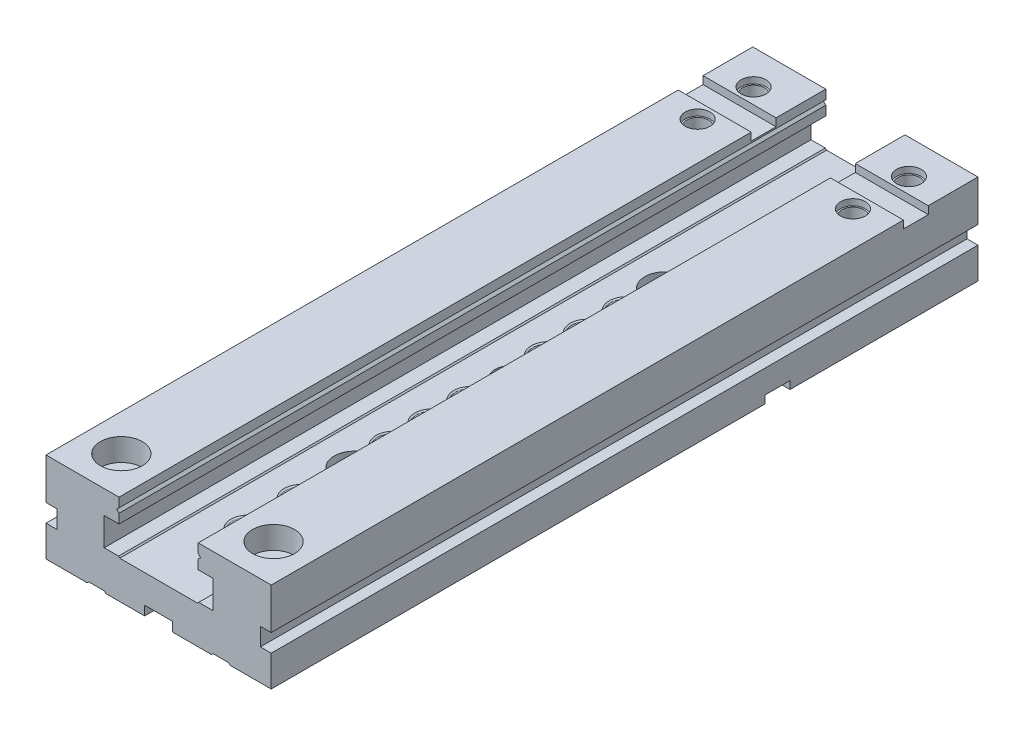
SolidWorks part; units mm, degrees
ref_plane "Front Plane" through (0, 0, 0) normal (0, 0, 1) x (1, 0, 0)
ref_plane "Top Plane" through (0, 0, 0) normal (0, 1, 0) x (1, 0, 0)
ref_plane "Right Plane" through (0, 0, 0) normal (1, 0, 0) x (0, 0, -1)
imported_body "Imported1"
sketch "Sketch1" plane through (0, -4.8, 0) normal (0, 1, 0) x (1, 0, 0)
  circle A0 centre (0, 126) radius 12.4968
  circle A1 centre (0, 326) radius 12.4968
  circle A2 centre (0, 226) radius 9.5
extrude "Boss-Extrude1" add sketch "Sketch1" against normal up to surface (18.2 mm away)
hole_wizard "Hole1" positions "Sketch3" profile "Sketch2" legacy
sketch "Sketch3" plane through (0, -4.8, 0) normal (0, 1, 0) x (1, 0, 0)
  line L1 (-25, 455) -> (25, 455) construction
  point P0 (0, 126)
  point P2 (0, 326)
  dimension "D1" = 129
  dimension "D2" = 200
sketch "Sketch2" plane through (0, -4.8, -126) normal (1, 0, 0) x (0, 0, 1)
  line L0 (0, 0) -> (0, 100)
  line L1 (0, 100) -> (8, 100)
  line L2 (8, 100) -> (8, 11)
  line L3 (8, 11) -> (13, 11)
  line L4 (13, 11) -> (13, 0)
  line L5 (13, 0) -> (0, 0)
  line L6 (0, 110) -> (0, -10) construction
  dimension "Diameter" = 16
  dimension "Depth" = 100
  dimension "C-Bore Diameter" = 26
  dimension "C-Bore Depth" = 11
hole_wizard "Hole2" positions "Sketch5" profile "Sketch4" legacy
sketch "Sketch5" plane through (0, -4.8, 0) normal (0, 1, 0) x (1, 0, 0)
  circle A0 centre (0, 126) radius 13 construction
  point P0 (0, 226)
  dimension "D1" = 100
sketch "Sketch4" plane through (0, -4.8, -226) normal (1, 0, 0) x (0, 0, 1)
  line L0 (0, 0) -> (0, 100)
  line L1 (0, 100) -> (6.5, 100)
  line L2 (6.5, 100) -> (6.5, 12.5)
  line L3 (6.5, 12.5) -> (9.5, 12.5)
  line L4 (9.5, 12.5) -> (9.5, 0)
  line L5 (9.5, 0) -> (0, 0)
  line L6 (0, 110) -> (0, -10) construction
  dimension "Diameter" = 13
  dimension "Depth" = 100
  dimension "C-Bore Diameter" = 19
  dimension "C-Bore Depth" = 12.5
